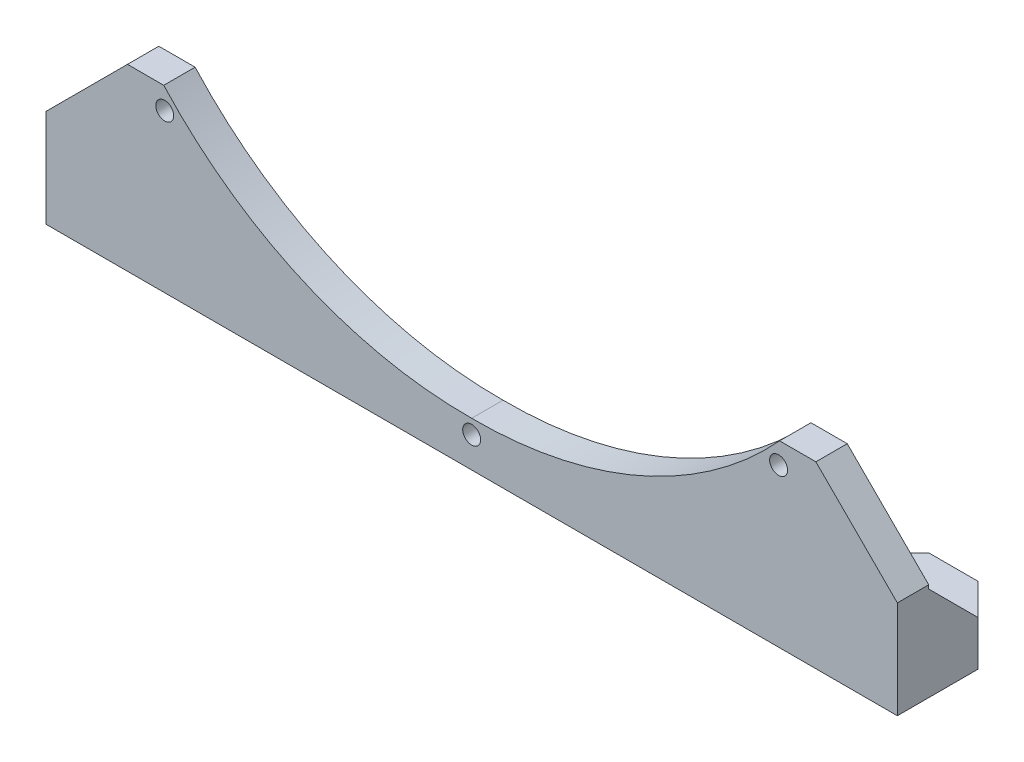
SolidWorks part; units mm, degrees
ref_plane "Front Plane" through (0, 0, 0) normal (0, 0, 1) x (1, 0, 0)
ref_plane "Top Plane" through (0, 0, 0) normal (0, 1, 0) x (1, 0, 0)
ref_plane "Right Plane" through (0, 0, 0) normal (1, 0, 0) x (0, 0, -1)
sketch "Sketch2" plane through (0, 0, 0) normal (0, 0, 1) x (1, 0, 0)
  line L0 (0, 0) -> (0, -131.7086) construction
  line L1 (120.65, -131.7086) -> (-120.65, -131.7086)
  line L2 (-120.65, -131.7086) -> (-120.65, -103.9966)
  line L3 (-87.2747, -80.9086) -> (-97.562, -80.9086)
  line L4 (-97.562, -80.9086) -> (-120.65, -103.9966)
  line L5 (97.562, -80.9086) -> (120.65, -103.9966)
  line L6 (87.2747, -80.9086) -> (97.562, -80.9086)
  line L7 (120.65, -131.7086) -> (120.65, -103.9966)
  line L8 (-47.0845, -111.3859) -> (-47.0845, -115.9579) construction
  line L9 (-47.0845, -113.6719) -> (-49.3705, -113.6719) construction
  arc A0 (-87.2747, -80.9086) -> (0, -119.0086) centre (-0.9485, -2.1725) ccw
  arc A1 (87.2747, -80.9086) -> (0, -119.0086) centre (0.9485, -2.1725) cw
  circle A5 centre (-87.0007, -87.0007) radius 2.286 construction
  circle A6 centre (0, -123.0376) radius 2.286
  circle A7 centre (0, 0) radius 123.0376 construction
  circle A9 centre (-87.0007, -87.0007) radius 2.286
  circle A10 centre (87.0007, -87.0007) radius 2.286
  dimension "D1" = 116.84
  dimension "D2" = 241.3
  dimension "D6" = 27.712
  dimension "D7" = 4.572
  dimension "D3" = 45
  dimension "D4" = 50.8
  dimension "D5" = 38.1
  dimension "D8" = 10.2873
extrude "Boss-Extrude1" add sketch "Sketch2" along normal blind 8.89
sketch "Sketch3" plane through (0, -131.7086, 0) normal (0, -1, 0) x (-1, 0, 0)
  line L0 (0, -8.89) -> (0, 0) construction
  line L1 (-120.65, -8.89) -> (-88.9, -8.89)
  line L2 (-120.65, -8.89) -> (-120.65, 22.86)
  line L3 (-120.65, 22.86) -> (-88.9, 22.86)
  line L4 (-88.9, -8.89) -> (-88.9, 22.86)
  line L5 (120.65, -8.89) -> (-120.65, -8.89) construction
  line L6 (120.65, 0) -> (-120.65, 0) construction
  line L7 (120.65, -8.89) -> (88.9, -8.89)
  line L8 (88.9, -8.89) -> (88.9, 22.86)
  line L9 (120.65, 22.86) -> (88.9, 22.86)
  line L10 (120.65, -8.89) -> (120.65, 22.86)
  line L11 (-104.775, 22.86) -> (-104.775, -8.89) construction
  circle A0 centre (-104.775, 10.16) radius 3.429
  circle A1 centre (104.775, 10.16) radius 3.429
  dimension "D2" = 19.05
  dimension "D3" = 6.858
  dimension "D1" = 31.75
extrude "Boss-Extrude2" add sketch "Sketch3" against normal blind 12.7
chamfer "Chamfer1" distance 13.97 angle 45 4 edges at (-88.9, -125.3586, 0) (-104.775, -119.0086, 0) (88.9, -125.3586, 0) (104.775, -119.0086, 0)
chamfer "Chamfer2" distance 8.89 angle 45 4 edges at (-88.9, -125.3586, -22.86) (-120.65, -125.3586, -22.86) (120.65, -125.3586, -22.86) (88.9, -125.3586, -22.86)
sketch "Sketch4" plane through (0, 0, 8.89) normal (0, 0, 1) x (1, 0, 0)
  circle A0 centre (-87.0007, -87.0007) radius 2.54
  circle A1 centre (0, -123.0376) radius 2.54
  circle A2 centre (87.0007, -87.0007) radius 2.54
  dimension "D1" = 5.08
extrude "Cut-Extrude1" cut sketch "Sketch4" against normal blind 4.572
sketch "Sketch5" plane through (0, -52.5193, 52.5193) normal (0, 0.7071, -0.7071) x (1, 0, 0)
  line L0 (-120.65, 94.0301) -> (-88.9, 94.0301) construction
  line L1 (-120.65, 74.2735) -> (-95.25, 74.2735)
  line L2 (-120.65, 74.2735) -> (-120.65, 94.0301)
  line L3 (-120.65, 94.0301) -> (-95.25, 94.0301)
  line L4 (-95.25, 74.2735) -> (-95.25, 94.0301)
  line L5 (-74.93, 74.2735) -> (-120.65, 74.2735) construction
  line L6 (-120.65, 74.2735) -> (-120.65, 94.0301) construction
  line L10 (-120.65, 74.2735) -> (120.65, 74.2735) construction
  line L11 (0, 74.2735) -> (0, 109.4079) construction
  line L12 (95.25, 74.2735) -> (95.25, 94.0301)
  line L13 (120.65, 94.0301) -> (95.25, 94.0301)
  line L14 (120.65, 74.2735) -> (120.65, 94.0301)
  line L15 (120.65, 74.2735) -> (95.25, 74.2735)
  dimension "D1" = 25.4
extrude "Boss-Extrude3" add sketch "Sketch5" against normal blind 2.54
